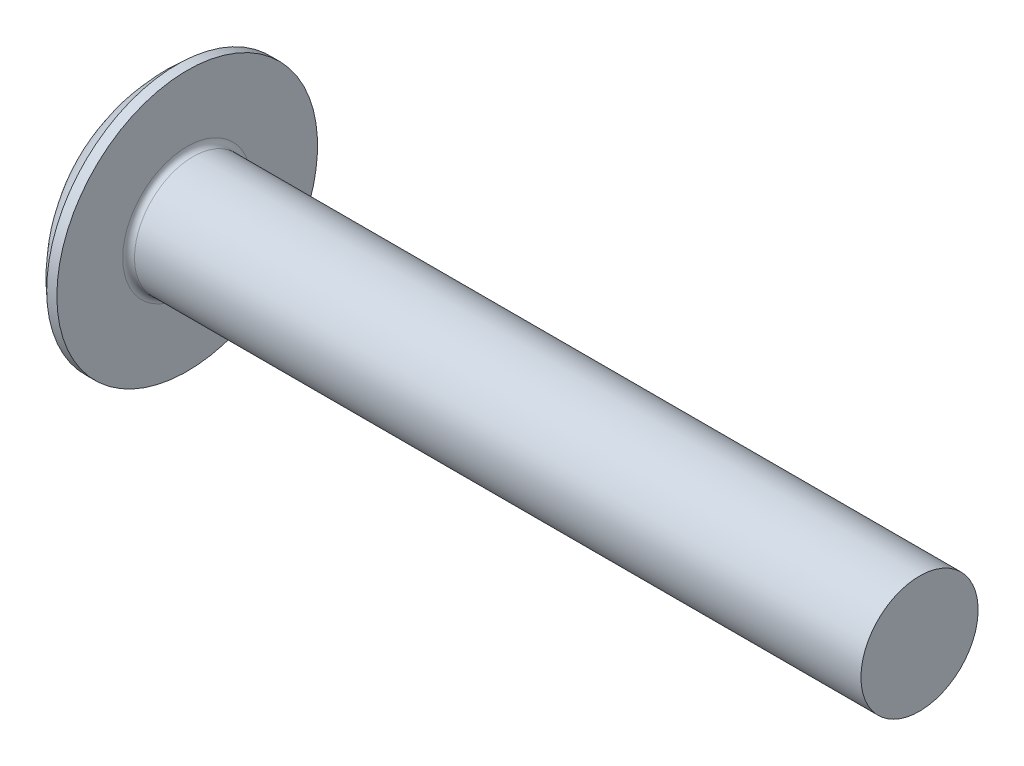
SolidWorks part; units mm, degrees
ref_plane "Front Plane" through (0, 0, 0) normal (0, 0, 1) x (1, 0, 0)
ref_plane "Top Plane" through (0, 0, 0) normal (0, 1, 0) x (1, 0, 0)
ref_plane "Right Plane" through (0, 0, 0) normal (1, 0, 0) x (0, 0, -1)
other "Configuration Table"
sketch "BodySke" plane through (0, 0, 0) normal (0, 0, 1) x (1, 0, 0)
  line L0 (0, 0) -> (111.3824, 0) construction
  line L1 (0, 0) -> (0, 8) construction
  line L2 (4.8, 4) -> (4.8, 8.9)
  line L3 (4.8, 8.9) -> (4.1053, 8.9)
  line L4 (4.8, 4) -> (54.8, 4)
  line L5 (54.8, 4) -> (54.8, 0)
  line L6 (6.05, 7.824) -> (6.05, -6.8939) construction
  line L7 (0, 0) -> (54.8, 0)
  line L8 (24.8, 8.824) -> (24.8, -4.958) construction
  arc A0 (0, 0) -> (4.1053, 8.9) centre (11.7, 0) cw
  point P10 (54.8, 3.4455)
revolve "BaseBody" add sketch "BodySke" angle 360 about L0
fillet "Fillet1" radius 0.4 1 edges at (4.8, 0, 4)
ref_plane "Plane1" through (4.36, 0, 0) normal (1, 0, 0) x (0, 0, -1)
sketch "RecSkeTop" plane through (0, 0, 0) normal (1, 0, 0) x (0, 0, -1)
  line L1 (-0.858, 3.9) -> (0.858, 3.9)
  line L2 (-0.858, 3.9) -> (-0.858, -3.9)
  line L3 (-0.858, -3.9) -> (0.858, -3.9)
  line L4 (0.858, 3.9) -> (0.858, -3.9)
sketch "RecSkeBot" plane through (4.36, 0, 0) normal (1, 0, 0) x (0, 0, -1)
  line L0 (-0.858, 3.9) -> (-0.858, -3.9) construction
  line L1 (-0.858, 1.7262) -> (0.858, 1.7262)
  line L2 (-0.858, 1.7262) -> (-0.858, -1.7262)
  line L3 (-0.858, -1.7262) -> (0.858, -1.7262)
  line L4 (0.858, 1.7262) -> (0.858, -1.7262)
  line L5 (0.858, 3.9) -> (0.858, -3.9) construction
loft "Recess" cut profiles "RecSkeTop", "RecSkeBot"
pattern_circular "RecPat" count 2 every 90 about axis through (0, 0, 0) along (1, 0, 0) of "Recess"
sketch "RecCorSke" plane through (0, 0, 0) normal (0, 0, 1) x (1, 0, 0)
  line L0 (0, 0) -> (57.5987, 0) construction
  line L1 (0, 0) -> (0, 1.8876)
  line L3 (0, 1.8876) -> (4.36, 1.5827)
  line L4 (4.36, 1.5827) -> (4.8743, 0)
  line L5 (4.8743, 0) -> (0, 0)
revolve "RecessCore" cut sketch "RecCorSke" angle 360 about L0
sketch "ThdSchSke" plane through (0, 0, 0) normal (0, 0, 1) x (1, 0, 0)
  line L0 (0, 0) -> (55.1256, 0) construction
  line L1 (0, 0) -> (111.3824, 0) construction
  line L2 (54.4799, 4) -> (54.4799, 4.6403)
  line L3 (54.4799, 4.6403) -> (55.1201, 4.6403)
  line L4 (55.1201, 4.6403) -> (55.1201, 4)
  line L5 (55.1201, 4) -> (54.8, 3.4455)
  line L6 (54.8, 3.4455) -> (54.4799, 4)
  line L7 (4.8, 4) -> (54.8, 4) construction
  line L13 (54.8, 4) -> (54.8, 0) construction
revolve "ThreadSchematic" [suppressed] cut sketch "ThdSchSke" angle 360 about L0
pattern_linear "ThdSchPat" [suppressed] count 24 along (1, 0, 0)
equation "\"Thread_minor@ThreadCosmetic\" = \"Thread_minor@BodySke\""
equation "\"D1@RecSkeTop\" = \"Cross_dia@RecSkeTop\" / 2"
equation "\"D2@RecSkeTop\" = \"Cross_dia@RecSkeTop\" * 0.22"
equation "\"D3@RecSkeTop\" = \"D2@RecSkeTop\" / 2"
equation "\"D1@RecSkeBot\" = \"Cross_dia@RecSkeTop\" - 2 * \"Cross_depth@Plane1\" *  tan( 26.5 * 0.017453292 ) "
equation "\"D2@RecSkeBot\" = \"D1@RecSkeBot\" / 2"
equation "\"D2@RecCorSke\" = \"Cross_depth@Plane1\""
equation "\"D3@RecCorSke\" = \"D2@RecSkeTop\" * 1.1"
equation "\"Advance@ThdSchPat\" = \"Advance@BodySke\""
equation "\"D1@ThdSchPat\" =  int( \"Thread_length@BodySke\" / \"Advance@ThdSchPat\" ) "
